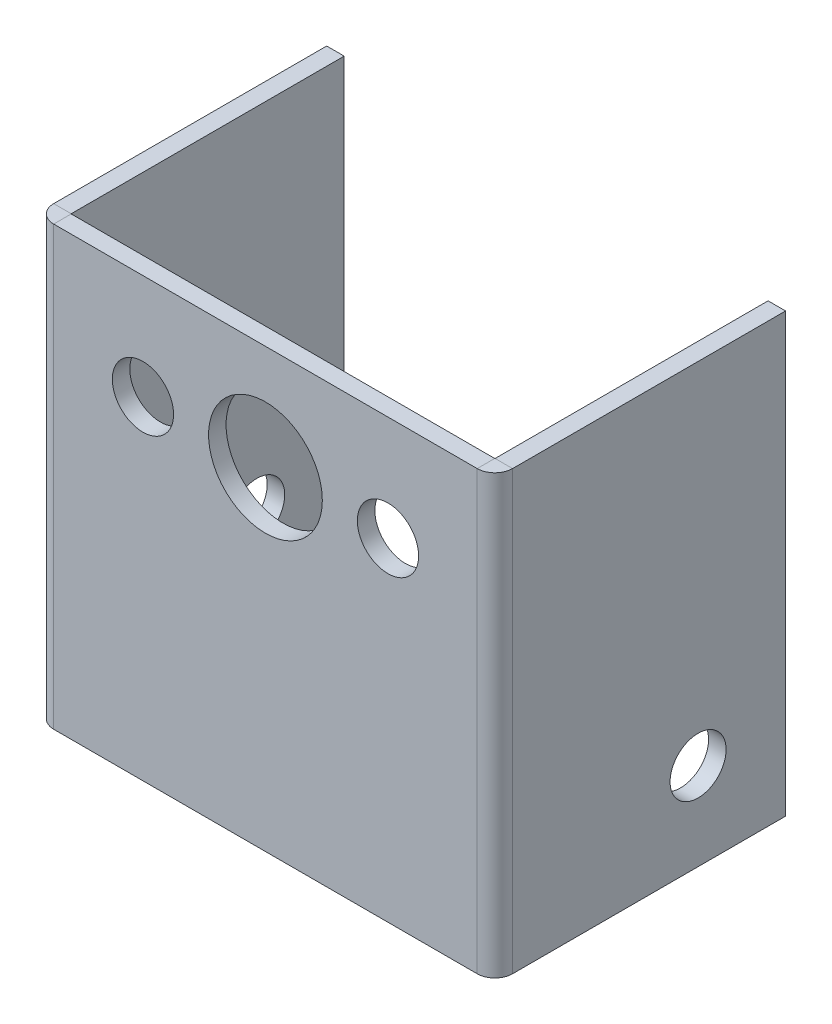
SolidWorks part; units mm, degrees
ref_plane "Front" through (0, 0, 0) normal (0, 0, 1) x (1, 0, 0)
ref_plane "Top" through (0, 0, 0) normal (0, 1, 0) x (1, 0, 0)
ref_plane "Right" through (0, 0, 0) normal (1, 0, 0) x (0, 0, -1)
sketch "Sketch1" plane through (0, 0, 0) normal (0, 0, 1) x (1, 0, 0)
  line L1 (0, 0) -> (57, 0)
  line L2 (0, 0) -> (0, 25)
  line L3 (0, 25) -> (57, 25)
  line L4 (57, 0) -> (57, 25)
  circle A0 centre (52, 5) radius 1.6
  circle A1 centre (5, 5) radius 1.6
  circle A2 centre (28.5, 19) radius 3.25
  circle A3 centre (21.5, 19) radius 1.75
  circle A4 centre (35.5, 19) radius 1.75
  dimension "D3" = 6
  dimension "D4" = 14
  dimension "D5" = 14
  dimension "D1" = 57
  dimension "D2" = 25
sheet metal parameters "Sheet-Metal1" thickness 1 parameters "D1"=0.01
base flange "Base-Flange1" sketch "Sketch1" thickness 1 reverse thickness direction yes parameters "D1"=0.01
sketch "Sketch3" plane through (0, 0, 1) normal (0, 0, 1) x (1, 0, 0)
  line L1 (41, 25) -> (41, 0)
  line L2 (16, 25) -> (16, 0)
sketched bend "Sketched Bend1" parameters "D1"=0
bend "SketchBend1" bend radius 0.01 bend angle 90 parameters "D5"=1
bend "SketchBend2" bend radius 0 bend angle 90 parameters "D5"=2
flat pattern "Flat-Pattern1"
sketch "Bend-Lines1" plane through (0, 0, 1) normal (0, 0, 1) x (1, 0, 0)
  line L0 (16, 25) -> (16, 0) construction
  line L1 (41, 25) -> (41, 0) construction
bend of the flat pattern "Flatten-<SketchBend1>1"
bend of the flat pattern "Flatten-<SketchBend2>1"
